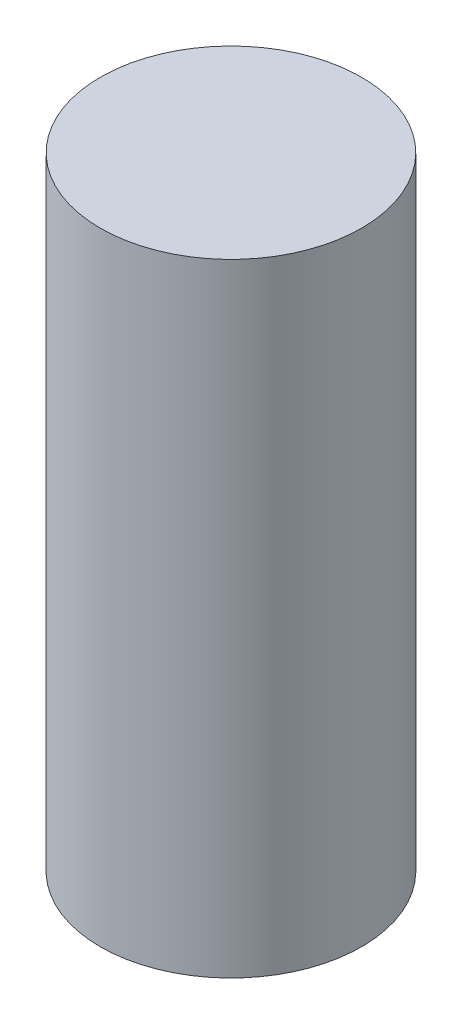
SolidWorks part; units mm, degrees
ref_plane "Front" through (0, 0, 0) normal (0, 0, 1) x (1, 0, 0)
ref_plane "Top" through (0, 0, 0) normal (0, 1, 0) x (1, 0, 0)
ref_plane "Right" through (0, 0, 0) normal (1, 0, 0) x (0, 0, -1)
sketch "Sketch1" plane through (0, 0, 0) normal (1, 0, 0) x (0, 0, -1)
  line L0 (0, 28.6885) -> (0, -92.3656) construction
  line L1 (0, 0) -> (3.15, 0)
  line L2 (3.15, 0) -> (3.15, -15)
  line L3 (3.15, -15) -> (0, -15)
  line L4 (0, -15) -> (0, 0)
  dimension "D1" = 6.3
  dimension "D2" = 15
revolve "Revolve1" add sketch "Sketch1" angle 360 about L0
